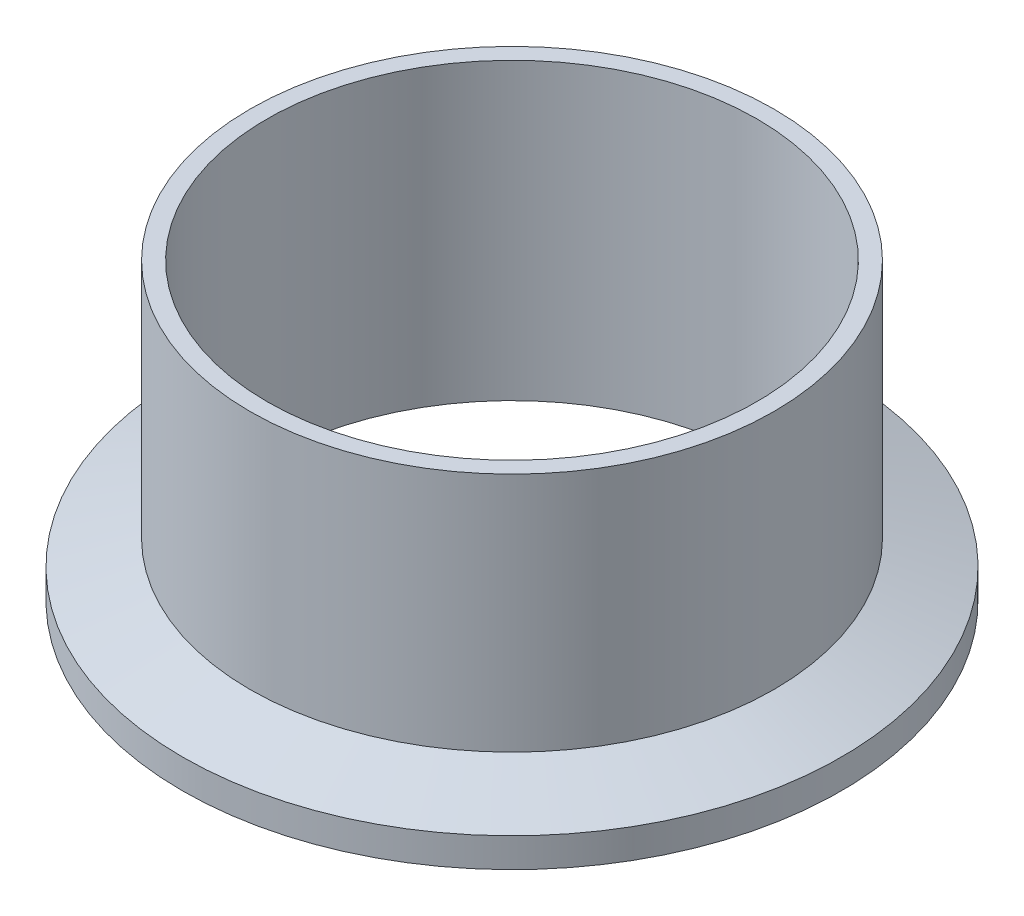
SolidWorks part; units mm, degrees
ref_plane "Front Plane" through (0, 0, 0) normal (0, 0, 1) x (1, 0, 0)
ref_plane "Top Plane" through (0, 0, 0) normal (0, 1, 0) x (1, 0, 0)
ref_plane "Right Plane" through (0, 0, 0) normal (1, 0, 0) x (0, 0, -1)
sketch "Sketch1" plane through (0, 0, 0) normal (0, 0, 1) x (1, 0, 0)
  line L0 (0, 0) -> (0, 28.575) construction
  line L1 (0, 28.575) -> (-25.4, 28.575)
  line L2 (-25.4, 28.575) -> (-25.4, 5.23)
  line L3 (-25.4, 5.23) -> (-31.9532, 2.8448)
  line L4 (-31.9532, 2.8448) -> (-31.9532, 0)
  line L5 (-31.9532, 0) -> (-29.9866, 0)
  line L6 (-26.3506, 0) -> (0, 0)
  line L7 (0, 0) -> (0, 28.575)
  line L8 (0, 28.575) -> (-23.749, 28.575)
  line L9 (-23.749, 28.575) -> (-23.749, 0)
  line L10 (-23.749, 0) -> (0, 0)
  line L11 (0, 0) -> (-0.1846, 0.0129)
  arc A0 (-29.2641, 0.4745) -> (-27.0731, 0.4745) centre (-28.1686, 0) cw
  arc A1 (-26.3506, 0) -> (-27.0731, 0.4745) centre (-26.3506, 0.7874) cw
  arc A2 (-29.2641, 0.4745) -> (-29.9866, 0) centre (-29.9866, 0.7874) cw
  point P12 (-26.9748, 0)
  point P19 (-31.9532, 0)
  dimension "D6" = 1.1938
  dimension "D7" = 0.7874
  dimension "D1" = 25.4
  dimension "D2" = 2.8448
  dimension "D3" = 31.9532
  dimension "D4" = 70
  dimension "D5" = 28.1686
  dimension "D8" = 1.651
  dimension "D9" = 28.575
revolve "Revolve2" add sketch "Sketch1" angle 360 about L0
